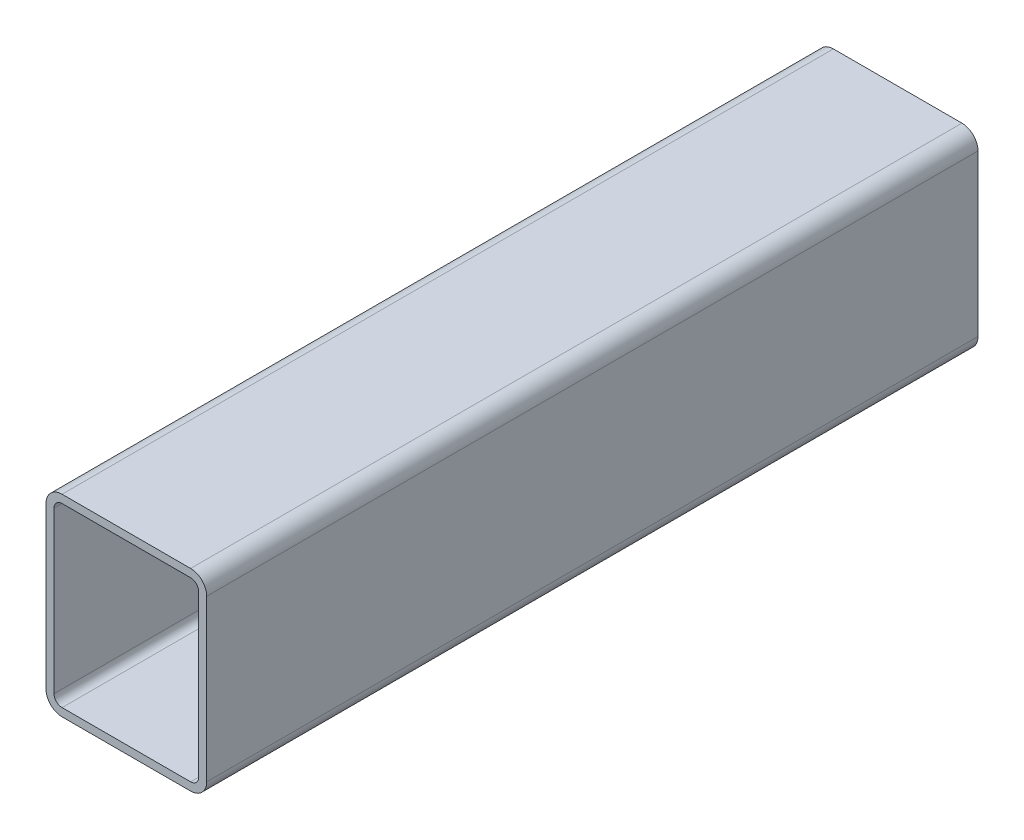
SolidWorks part; units mm, degrees
ref_plane "Front Plane" through (0, 0, 0) normal (0, 0, 1) x (1, 0, 0)
ref_plane "Top Plane" through (0, 0, 0) normal (0, 1, 0) x (1, 0, 0)
ref_plane "Right Plane" through (0, 0, 0) normal (1, 0, 0) x (0, 0, -1)
sketch "Sketch1" plane through (0, 0, 0) normal (0, 0, 1) x (1, 0, 0)
sketch_block_instance "HSS3x2.5x0.125-1"
sketch_block "HSS3x2.5x0.125"
extrude "Boss-Extrude1" add sketch "Sketch1" along normal blind 304.8
